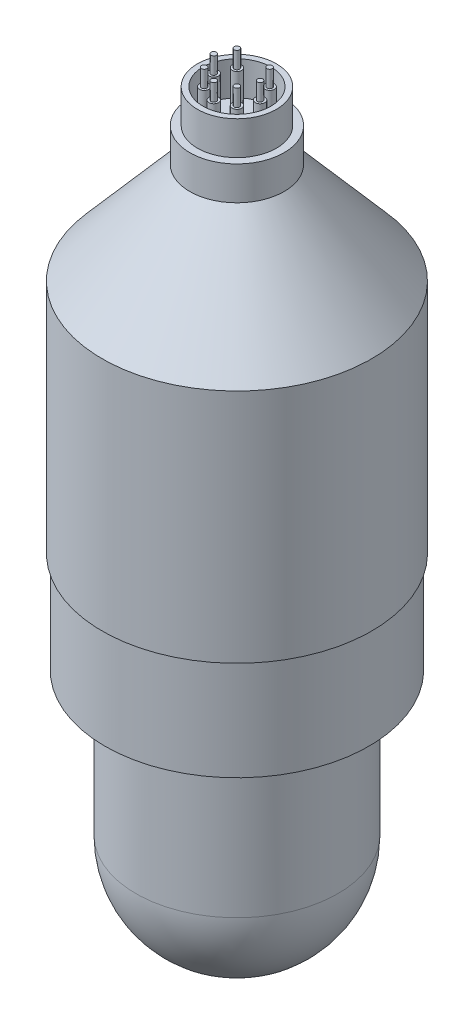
SolidWorks part; units mm, degrees
ref_plane "Front" through (0, 0, 0) normal (0, 0, 1) x (1, 0, 0)
ref_plane "Top" through (0, 0, 0) normal (0, 1, 0) x (1, 0, 0)
ref_plane "Right" through (0, 0, 0) normal (1, 0, 0) x (0, 0, -1)
sketch "Sketch1" plane through (0, 0, 0) normal (0, 1, 0) x (1, 0, 0)
  line L1 (10.9985, 0) -> (5.4993, 9.525)
  line L2 (5.4993, 9.525) -> (-5.4993, 9.525)
  line L3 (-5.4993, 9.525) -> (-10.9985, 0)
  line L4 (-10.9985, 0) -> (-5.4993, -9.525)
  line L5 (-5.4993, -9.525) -> (5.4993, -9.525)
  line L6 (5.4993, -9.525) -> (10.9985, 0)
  circle A0 centre (0, 0) radius 9.525 construction
  dimension "D1" = 19.05
extrude "Extrude1" add sketch "Sketch1" along normal blind 7.62
sketch "Sketch2" plane through (0, 7.62, 0) normal (0, 1, 0) x (-1, 0, 0)
  circle A0 centre (0, 0) radius 9.3121
extrude "Extrude2" add sketch "Sketch2" along normal blind 4.064
sketch "Sketch3" plane through (0, 11.684, 0) normal (0, 1, 0) x (-1, 0, 0)
  circle A0 centre (0, 0) radius 12.7
  dimension "D1" = 25.4
extrude "Extrude3" add sketch "Sketch3" along normal blind 19.812
sketch "Sketch7" plane through (0, 31.496, 0) normal (0, 1, 0) x (-1, 0, 0)
  circle A0 centre (-8.7313, 0) radius 1.7859
  dimension "D1" = 3.5719
  dimension "D2" = 8.7313
extrude "Extrude5" add sketch "Sketch7" along normal blind 12.7
sketch "Sketch8" plane through (0, 44.196, 0) normal (0, 1, 0) x (-1, 0, 0)
  circle A0 centre (-8.7313, 0) radius 1.0155
extrude "Extrude6" add sketch "Sketch8" along normal blind 6.35
pattern_circular "CirPattern1" count 8 every 45
sketch "Sketch4" plane through (0, 0, 0) normal (0, -1, 0) x (1, 0, 0)
  circle A0 centre (0, 0) radius 4.8006
  dimension "D1" = 9.6012
extrude "Extrude4" add sketch "Sketch4" along normal blind 1.27
sketch "Sketch5" plane through (0, -1.27, 0) normal (0, -1, 0) x (1, 0, 0)
  circle A0 centre (0, 0) radius 5.5562
  dimension "D1" = 11.1125
extrude "7/16-20-UNF-2A" add sketch "Sketch5" along normal offset from surface (17.78 mm away) 19.05
sketch "Sketch6" plane through (0, 0, 0) normal (0, 0, 1) x (1, 0, 0)
  line L0 (6.2103, 0) -> (6.2103, 1.27)
  line L1 (5.4993, 0) -> (10.9985, 0) construction
  line L2 (6.2103, 1.27) -> (8.7757, 1.27)
  line L3 (8.7757, 1.27) -> (8.7757, 0)
  line L4 (8.7757, 0) -> (6.2103, 0)
  line L5 (0, 0) -> (0, 3.7308) construction
  line L6 (0, 11.684) -> (0, 7.62) construction
  line L7 (-6.2103, 0) -> (-6.2103, 1.27) construction
  dimension "D1" = 12.4206
  dimension "D2" = 2.5654
  dimension "D3" = 1.27
revolve "#2-014" cut sketch "Sketch6" angle 360 about L5
sketch "Sketch9" plane through (0, 0, 0) normal (0, 0, 1) x (1, 0, 0)
  line L0 (14.8868, 44.196) -> (14.8868, 31.496)
  line L1 (14.8868, 31.496) -> (17.78, 31.496)
  line L2 (17.78, 31.496) -> (17.78, 18.796)
  line L3 (17.78, 18.796) -> (50.8, -19.304)
  line L4 (50.8, -19.304) -> (50.8, -146.304)
  line L5 (50.8, -146.304) -> (38.1, -146.304)
  line L6 (38.1, -146.304) -> (38.1, -200.279)
  line L7 (0, -238.379) -> (0, -19.177)
  line L8 (12.7, 31.496) -> (-12.7, 31.496) construction
  line L9 (14.8868, 44.196) -> (12.827, 44.196)
  line L10 (0.127, -19.177) -> (5.6833, -19.177) construction
  line L11 (12.7, 11.684) -> (9.3121, 11.684) construction
  line L12 (0, 0) -> (0, 72.7155) construction
  line L14 (-12.7, 11.684) -> (12.7, 11.684) construction
  line L15 (9.3121, 7.62) -> (9.3121, 11.684) construction
  line L16 (9.3121, 7.62) -> (9.3121, 11.684) construction
  line L17 (5.4993, 7.62) -> (10.9985, 7.62) construction
  line L18 (9.3121, 7.62) -> (10.9985, 7.62) construction
  line L19 (10.9985, 7.62) -> (10.9985, 0) construction
  line L20 (10.9985, 7.62) -> (10.9985, 0) construction
  line L21 (5.4993, 0) -> (10.9985, 0) construction
  line L22 (4.8006, 0) -> (10.9985, 0) construction
  line L23 (4.8006, -1.27) -> (4.8006, 0) construction
  line L24 (4.8006, -1.27) -> (4.8006, 0) construction
  line L25 (5.5562, -19.05) -> (5.5562, -1.27) construction
  line L26 (5.5562, -19.05) -> (5.5562, -1.27) construction
  line L27 (5.5562, -1.27) -> (-5.5562, -1.27) construction
  line L28 (5.5562, -1.27) -> (4.8006, -1.27) construction
  line L29 (-5.5562, -19.05) -> (5.5562, -19.05) construction
  line L30 (0, -19.05) -> (5.5562, -19.05) construction
  line L31 (12.7, 11.684) -> (12.7, 31.496) construction
  line L32 (12.7, 11.684) -> (12.7, 44.196) construction
  line L33 (0, -238.379) -> (0, -19.05) construction
  line L34 (0, -19.177) -> (5.6833, -19.177)
  line L35 (5.6833, -19.177) -> (5.6833, -1.143)
  line L36 (5.6833, -1.143) -> (4.9276, -1.143)
  line L37 (4.9276, -1.143) -> (4.9276, -0.127)
  line L38 (4.9276, -0.127) -> (11.1255, -0.127)
  line L39 (11.1255, 7.747) -> (11.1255, -0.127)
  line L40 (9.4391, 7.747) -> (11.1255, 7.747)
  line L41 (9.4391, 7.747) -> (9.4391, 11.557)
  line L42 (12.827, 11.557) -> (9.4391, 11.557)
  line L43 (12.827, 11.557) -> (12.827, 44.196)
  line L44 (12.827, 11.557) -> (12.827, 44.069) construction
  line L45 (14.8868, 44.069) -> (12.827, 44.069) construction
  line L46 (14.8868, 44.196) -> (12.7, 44.196) construction
  line L48 (0.127, -238.379) -> (0.127, -19.177) construction
  arc A0 (0, -238.379) -> (38.1, -200.279) centre (0, -200.279) ccw
  dimension "D2" = 50.8
  dimension "D3" = 127
  dimension "D4" = 12.7
  dimension "D5" = 12.7
  dimension "D6" = 38.1
  dimension "D7" = 17.78
  dimension "D8" = 288.925
  dimension "D9" = 92.075
  dimension "D11" = 76.2
  dimension "D10" = 0.127
revolve "Revolve1" add sketch "Sketch9" angle 360 about L12
sketch "Sketch10" plane through (0, 0, 0) normal (0, 0, 1) x (1, 0, 0)
  line L0 (0, 0) -> (0, -132.2583) construction
  line L1 (0, -19.304) -> (0, -146.304) construction
  line L2 (0, -177.419) -> (0, -245.999) construction
  line L3 (0, -146.304) -> (0, -200.279) construction
  line L4 (0, -187.579) -> (20.6375, -187.579)
  line L5 (0, -187.579) -> (0, -214.5665)
  line L6 (0, -214.5665) -> (20.6375, -214.5665)
  line L7 (20.6375, -187.579) -> (20.6375, -214.5665)
  line L8 (38.1, -200.279) -> (-38.1, -200.279) construction
  dimension "D1" = 26.9875
  dimension "D2" = 14.2875
  dimension "D3" = 41.275
revolve "FlashTube" cut sketch "Sketch10" angle 360 about L0
sketch "Sketch11" plane through (0, 0, 0) normal (0, 0, 1) x (1, 0, 0)
  line L0 (0, 0) -> (0, -74.0999) construction
  line L1 (49.784, -108.204) -> (70.0687, -108.204)
  line L2 (49.784, -108.204) -> (49.784, -160.856)
  line L3 (49.784, -160.856) -> (70.0687, -160.856)
  line L4 (70.0687, -108.204) -> (70.0687, -160.856)
  line L5 (0, -19.304) -> (0, -146.304) construction
  line L6 (50.8, -146.304) -> (50.8, -19.304) construction
  line L7 (-50.8, -146.304) -> (50.8, -146.304) construction
  dimension "D1" = 1.016
  dimension "D2" = 99.568
  dimension "D3" = 38.1
revolve "Cut-Revolve1" cut sketch "Sketch11" angle 360 about L0
sketch "Sketch12" plane through (0, 0, 0) normal (0, 0, 1) x (1, 0, 0)
  line L0 (0, -200.279) -> (8978.8696, -5280.279)
  line L1 (38.1, -200.279) -> (-38.1, -200.279) construction
  line L2 (0, -200.279) -> (0, 202.961) construction
  line L3 (0, -200.279) -> (0, -5280.279)
  line L4 (0, -5280.279) -> (8978.8696, -5280.279)
  dimension "D1" = 60.5
  dimension "D2" = 5080
revolve "FOV-Revolve2" [suppressed] add sketch "Sketch12" angle 360 about L2
sketch "Sketch13" [suppressed] plane through (0, 0, 0) normal (0, 0, 1) x (1, 0, 0)
  line L1 (-2.0693, -217.2083) -> (-571.9819, -1664.0157)
  line L2 (0, -211.9551) -> (0, -342.4113) construction
  line L4 (-20.6375, -211.9551) -> (20.6375, -211.9551) construction
  line L6 (-2.0693, -217.2083) -> (0, -211.9551) construction
  line L8 (-2587.1458, -1664.0157) -> (2587.1458, -1664.0157) construction
  dimension "D1" = 21.5
ref_plane "Plane1" [suppressed] through (0, -304.8, 0) normal (0, 1, 0) x (-1, 0, 0)
sketch "Sketch15" [suppressed] plane through (0, -304.8, 0) normal (0, 1, 0) x (-1, 0, 0)
  line L0 (0, 0) -> (0, -254)
ref_plane "Plane2" [suppressed] through (131.9823, -76.2, 0) normal (-0.866, 0.5, 0) x (0, 0, 1)
sketch "Sketch16" [suppressed] plane through (131.9823, -76.2, 0) normal (-0.866, 0.5, 0) x (0, 0, 1)
  line L1 (10762.8874, -191.7368) -> (-11110.8106, -191.7368)
  line L2 (10762.8874, -191.7368) -> (10762.8874, -9677.5169)
  line L3 (10762.8874, -9677.5169) -> (-11110.8106, -9677.5169)
  line L4 (-11110.8106, -191.7368) -> (-11110.8106, -9677.5169)
extrude "Extrude7" [suppressed] cut sketch "Sketch16" along normal blind 6350
